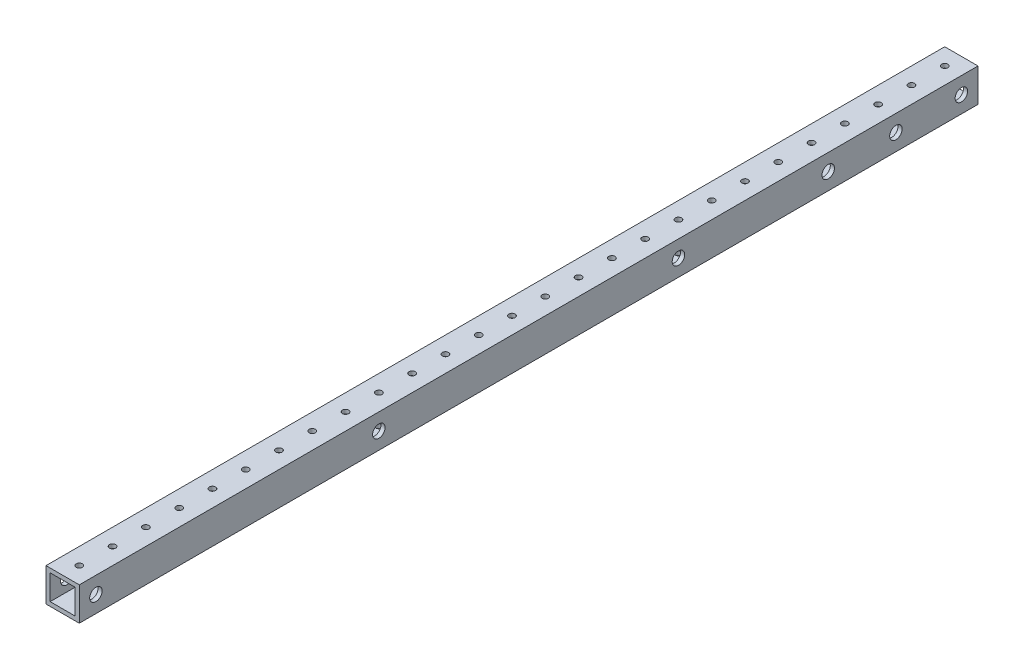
SolidWorks part; units mm, degrees
ref_plane "Front" through (0, 0, 0) normal (0, 0, 1) x (1, 0, 0)
ref_plane "Top" through (0, 0, 0) normal (0, 1, 0) x (1, 0, 0)
ref_plane "Right" through (0, 0, 0) normal (1, 0, 0) x (0, 0, -1)
sketch "Sketch1" plane through (0, 0, 0) normal (0, 0, 1) x (1, 0, 0)
  line L0 (-9.525, 9.525) -> (-9.525, -9.525)
  line L1 (-12.7, 12.7) -> (12.7, 12.7)
  line L2 (-12.7, 12.7) -> (-12.7, -12.7)
  line L3 (-12.7, -12.7) -> (12.7, -12.7)
  line L4 (12.7, 12.7) -> (12.7, -12.7)
  line L5 (-12.7, 12.7) -> (12.7, -12.7) construction
  line L6 (-12.7, -12.7) -> (12.7, 12.7) construction
  line L7 (-9.525, -9.525) -> (9.525, -9.525)
  line L8 (9.525, 9.525) -> (9.525, -9.525)
  line L9 (-9.525, 9.525) -> (9.525, 9.525)
  point P0 (0, 0)
  dimension "D1" = 25.4
  dimension "D2" = 25.4
  dimension "D3" = 3.175
extrude "Boss-Extrude1" add sketch "Sketch1" along normal mid plane 685.8 contours L0 L7 L8 L9 | L4 L3 L2 L1
sketch "Sketch2" plane through (12.7, 0, 0) normal (1, 0, 0) x (0, 0, -1)
  line L0 (-342.9, 12.7) -> (-342.9, -12.7) construction
  line L1 (342.9, 12.7) -> (342.9, -12.7) construction
  line L4 (0, -47.8906) -> (0, 81.9631) construction
  circle A0 centre (-330.2, 0) radius 4.7625
  circle A1 centre (330.2, 0) radius 4.7625
  circle A2 centre (-114.3, 0) radius 4.7625
  circle A3 centre (114.3, 0) radius 4.7625
  point P10 (342.9, 0)
  dimension "D2" = 9.525
  dimension "D3" = 12.7
  dimension "D4" = 12.7
  dimension "D5" = 114.3
  dimension "D6" = 114.3
extrude "Cut-Extrude1" cut sketch "Sketch2" against normal through all
sketch "Sketch3" plane through (0, -12.7, 0) normal (0, -1, 0) x (1, 0, 0)
  line L0 (0, 393.1851) -> (0, -397.6838) construction
  line L1 (-12.7, 342.9) -> (12.7, 342.9) construction
  circle A0 centre (0, 330.2) radius 2.3813
  dimension "D1" = 4.7625
  dimension "D2" = 12.7
extrude "Cut-Extrude2" cut sketch "Sketch3" against normal through all
pattern_linear "LPattern1" count 30 spacing 25.4 along (0, 0, -1) of "Cut-Extrude2"
sketch "Sketch6" plane through (12.7, 0, 0) normal (1, 0, 0) x (0, 0, -1)
  line L0 (342.9, 0) -> (228.6, 0) construction
  line L1 (342.9, 12.7) -> (342.9, -12.7) construction
  line L2 (228.6, 0) -> (280.2636, 0) construction
  circle A0 centre (228.6, 0) radius 4.7625
  circle A1 centre (280.2636, 0) radius 4.7625
  dimension "D2" = 9.525
  dimension "D3" = 51.6636
  dimension "D1" = 114.3
extrude "Cut-Extrude5" cut sketch "Sketch6" against normal up to next
sketch "Sketch7" plane through (-12.7, 0, 0) normal (-1, 0, 0) x (0, 0, 1)
  circle A0 centre (-280.2636, 0) radius 2.4892
  circle A1 centre (-228.6, 0) radius 2.4892
  dimension "D1" = 4.9784
extrude "Cut-Extrude6" cut sketch "Sketch7" against normal up to next
